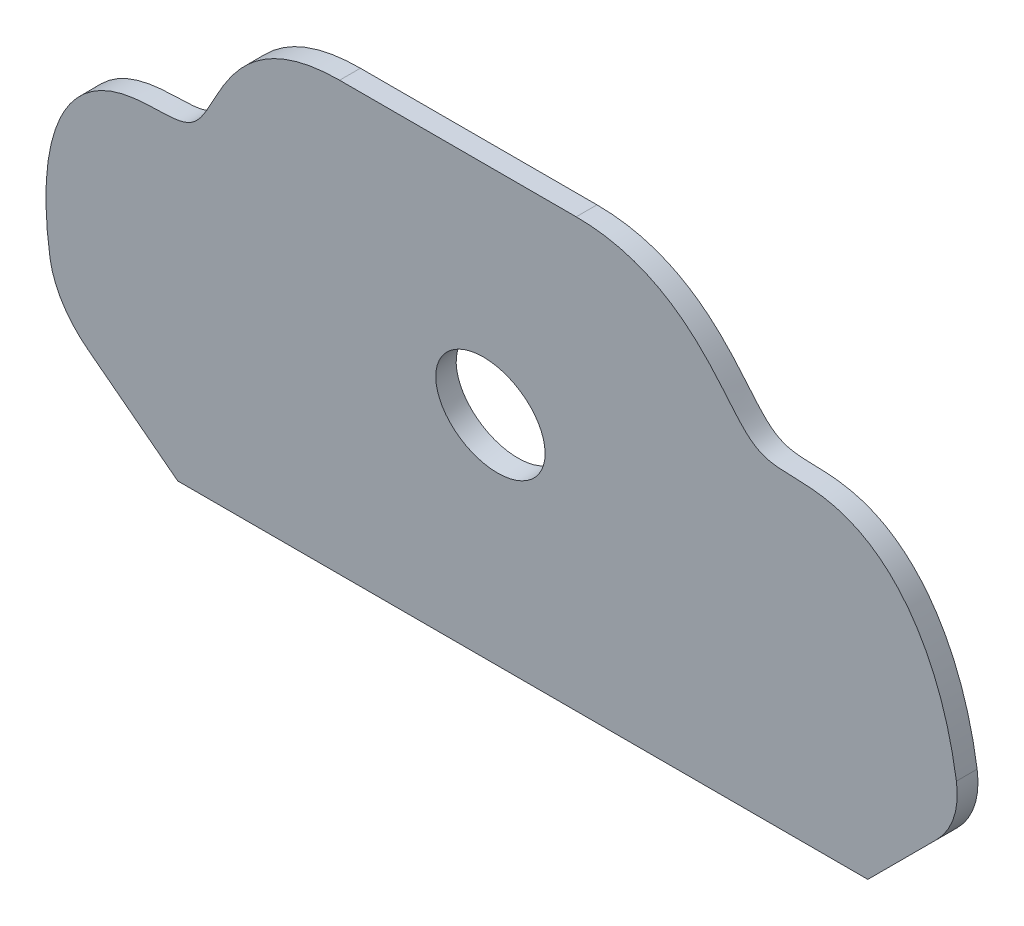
SolidWorks part; units mm, degrees
ref_plane "Front Plane" through (0, 0, 0) normal (0, 0, 1) x (1, 0, 0)
ref_plane "Top Plane" through (0, 0, 0) normal (0, 1, 0) x (1, 0, 0)
ref_plane "Right Plane" through (0, 0, 0) normal (1, 0, 0) x (0, 0, -1)
sketch "Sketch1" plane through (0, 0, 0) normal (0, 0, 1) x (1, 0, 0)
  line L0 (0, 250) -> (0, 0) construction
  line L1 (-229.8635, 75.5742) -> (-229.8635, 220.5742) construction
  line L2 (-229.8635, 220.5742) -> (-130.6572, 208) construction
  line L3 (-130.6572, 208) -> (-130.6572, 108) construction
  line L4 (-130.6572, 108) -> (-160, 250) construction
  line L5 (-160, 250) -> (-60, 250) construction
  line L6 (-60, 250) -> (60, 250)
  line L8 (-175, 0) -> (175, 0)
  line L9 (229.8635, 75.5742) -> (229.8635, 220.5742) construction
  line L10 (229.8635, 220.5742) -> (130.6572, 208) construction
  line L11 (130.6572, 208) -> (130.6572, 108) construction
  line L12 (130.6572, 108) -> (160, 250) construction
  line L13 (160, 250) -> (60, 250) construction
  line L16 (-175, 0) -> (-215.2188, 40.2188)
  line L17 (175, 0) -> (215.2188, 40.2188)
  line L18 (-178.8736, 0) -> (178.8736, 0) construction
  arc A0 (-215.2188, 40.2188) -> (-229.8635, 75.5742) centre (-179.8635, 75.5742) cw
  arc A1 (215.2188, 40.2188) -> (229.8635, 75.5742) centre (179.8635, 75.5742) ccw
  spline_without_curve S0
  spline_without_curve S1
  dimension "D10" = 100
  dimension "D4" = 50
  dimension "D5" = 50
  dimension "D6" = 45
  dimension "D1" = 250
  dimension "D2" = 175
  dimension "D3" = 60
  dimension "D7" = 100
  dimension "D8" = 145
  dimension "D9" = 145
  dimension "D11" = 108
  dimension "D12" = 145
  dimension "D13" = 145
  dimension "D14" = 100
  dimension "D15" = 208
extrude "Boss-Extrude1" add sketch "Sketch1" along normal mid plane 50
sketch "Sketch2" plane through (0, 0, 0) normal (1, 0, 0) x (0, 0, -1)
  line L2 (23.0397, -10) -> (-12.5064, 260)
  line L4 (-23.0397, 260) -> (12.5064, -10)
  line L5 (-23.0397, 260) -> (-35, 260)
  line L6 (-35, 260) -> (-35, -10)
  line L7 (-35, -10) -> (12.5064, -10)
  line L10 (23.0397, -10) -> (35, -10)
  line L11 (35, -10) -> (35, 260)
  line L12 (35, 260) -> (-12.5064, 260)
  line L13 (-25, 250) -> (25, 250) construction
  line L14 (27.5, 0) -> (-27.5, 0) construction
  line L15 (-25, 250) -> (-25, 75.5742) construction
  line L16 (25, 75.5742) -> (25, 250) construction
  point P2 (16.2732, -30.0222)
  point P5 (29.5661, -34.0176)
  dimension "D1" = 97.5
  dimension "D2" = 10
  dimension "D3" = 10
  dimension "D4" = 10
  dimension "D5" = 10
extrude "Cut-Extrude1" cut sketch "Sketch2" against normal through all both and the other way through all contours L4 L7 L6 L5 | L2 L12 L11 L10
sketch "Sketch4" plane through (0, 2.8112, -21.3531) normal (0, 0.1305, -0.9914) x (-1, 0, 0)
  line L0 (60, 249.3218) -> (-60, 249.3218) construction
  circle A0 centre (0, 124.3218) radius 27.5
  point P4 (0, 0)
  point P6 (0, 0)
  dimension "D2" = 55
  dimension "D1" = 125
extrude "Cut-Extrude2" cut sketch "Sketch4" against normal through all both and the other way through all
equation "\"`15\"=153.387"
